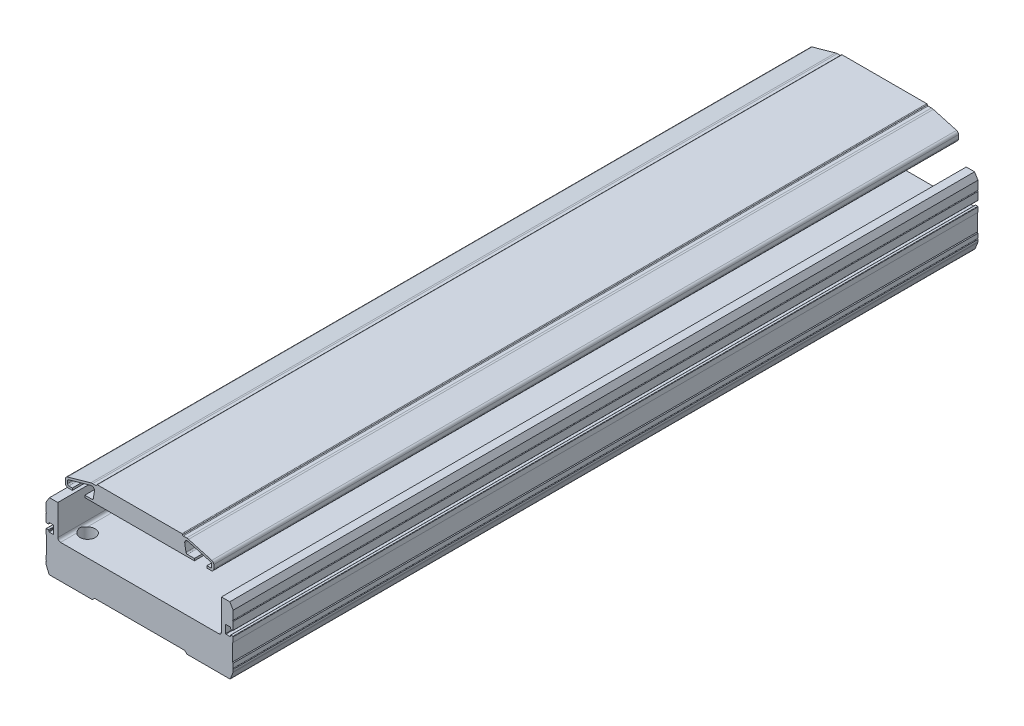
SolidWorks part; units mm, degrees
ref_plane "前视基准面" through (0, 0, 0) normal (0, 0, 1) x (1, 0, 0)
ref_plane "上视基准面" through (0, 0, 0) normal (0, 1, 0) x (1, 0, 0)
ref_plane "右视基准面" through (0, 0, 0) normal (1, 0, 0) x (0, 0, -1)
sketch "草图1" plane through (0, 0, 0) normal (0, 0, 1) x (1, 0, 0)
  line B0 (-39.5, 59.4) -> (39.5, 59.4)
  line B1 (39.5, 59.4) -> (39.5, 60.9)
  line B2 (39.5, 60.9) -> (34.4, 60.9)
  line B3 (33.4138, 61.7343) -> (32.5361, 66.9593)
  line B4 (35.0485, 69.2164) -> (51.27, 64.6675)
  line B5 (52, 63.7046) -> (52, 61.9)
  line B6 (51, 60.9) -> (48.5, 60.9)
  line B7 (48.5, 60.9) -> (48.5, 59.4)
  line B8 (48.5, 59.4) -> (51.5, 59.4)
  line B9 (53.5, 61.4) -> (53.5, 64.0837)
  line B10 (52.04, 66.0094) -> (35.2622, 70.7143)
  line B11 (33.9122, 70.9) -> (31.5, 70.9)
  line B12 (30.5, 71.9) -> (-30.5, 71.9)
  line B13 (-31.5, 70.9) -> (-33.9122, 70.9)
  line B14 (-35.2622, 70.7143) -> (-52.04, 66.0094)
  line B15 (-53.5, 64.0837) -> (-53.5, 61.4)
  line B16 (-51.5, 59.4) -> (-48.5, 59.4)
  line B17 (-48.5, 59.4) -> (-48.5, 60.9)
  line B18 (-48.5, 60.9) -> (-51, 60.9)
  line B19 (-52, 61.9) -> (-52, 63.7046)
  line B20 (-51.27, 64.6675) -> (-35.0485, 69.2164)
  line B21 (-32.5361, 66.9593) -> (-33.4138, 61.7343)
  line B22 (-34.4, 60.9) -> (-39.5, 60.9)
  line B23 (-39.5, 60.9) -> (-39.5, 59.4)
  line B24 (-67, 22) -> (-67, 10)
  line B25 (-67, 10) -> (-67.5, 9.5)
  line B26 (-67.5, 9.5) -> (-67.5, 6.375)
  line B27 (-67.5, 5.625) -> (-67.5, 4.3812)
  line B28 (-67.36, 3.6469) -> (-65.5064, -1.0289)
  line B29 (-65.16, -1.6) -> (-34.1, -1.6)
  line B30 (-34.1, -1.6) -> (-32.5, 0)
  line B31 (-32.5, 0) -> (32.5, 0)
  line B32 (32.5, 0) -> (34.1, -1.6)
  line B33 (34.1, -1.6) -> (65.16, -1.6)
  line B34 (65.5064, -1.0289) -> (67.36, 3.6469)
  line B35 (67.5, 4.3812) -> (67.5, 5.625)
  line B36 (67.5, 6.375) -> (67.5, 9.5)
  line B37 (67.5, 9.5) -> (67, 10)
  line B38 (67, 10) -> (67, 22)
  line B39 (67, 22) -> (67.5, 22.5)
  line B40 (67.5, 22.5) -> (67.5, 25.9)
  line B41 (67.2, 26.2) -> (65.8, 26.2)
  line B42 (65.5, 25.9) -> (65.5, 25.3)
  line B43 (65.2, 25) -> (62.3, 25)
  line B44 (62, 25.3) -> (62, 30.7)
  line B45 (62.3, 31) -> (65.2, 31)
  line B46 (65.5, 30.7) -> (65.5, 30.1)
  line B47 (65.8, 29.8) -> (67.2, 29.8)
  line B48 (67.5, 30.1) -> (67.5, 35.625)
  line B49 (67.5, 36.375) -> (67.5, 42.6)
  line B50 (67.5, 42.6) -> (65, 46.6)
  line B51 (65, 46.6) -> (59, 46.6)
  line B52 (59, 46.6) -> (59, 24.7)
  line B53 (57, 22.7) -> (-57, 22.7)
  line B54 (-59, 24.7) -> (-59, 46.6)
  line B55 (-59, 46.6) -> (-65, 46.6)
  line B56 (-65, 46.6) -> (-67.5, 42.6)
  line B57 (-67.5, 42.6) -> (-67.5, 36.375)
  line B58 (-67.5, 35.625) -> (-67.5, 30.1)
  line B59 (-67.2, 29.8) -> (-65.8, 29.8)
  line B60 (-65.5, 30.1) -> (-65.5, 30.7)
  line B61 (-65.2, 31) -> (-62.3, 31)
  line B62 (-62, 30.7) -> (-62, 25.3)
  line B63 (-62.3, 25) -> (-65.2, 25)
  line B64 (-65.5, 25.3) -> (-65.5, 25.9)
  line B65 (-65.8, 26.2) -> (-67.2, 26.2)
  line B66 (-67.5, 25.9) -> (-67.5, 22.5)
  line B67 (-67.5, 22.5) -> (-67, 22)
  arc B68 (33.4138, 61.7343) -> (34.4, 60.9) centre (34.4, 61.9) ccw
  arc B69 (35.0485, 69.2164) -> (32.5361, 66.9593) centre (34.5085, 67.2906) ccw
  arc B70 (52, 63.7046) -> (51.27, 64.6675) centre (51, 63.7046) ccw
  arc B71 (51, 60.9) -> (52, 61.9) centre (51, 61.9) ccw
  arc B72 (51.5, 59.4) -> (53.5, 61.4) centre (51.5, 61.4) ccw
  arc B73 (53.5, 64.0837) -> (52.04, 66.0094) centre (51.5, 64.0837) ccw
  arc B74 (35.2622, 70.7143) -> (33.9122, 70.9) centre (33.9122, 65.9) ccw
  arc B75 (31, 71.4) -> (31.5, 70.9) centre (31.5, 71.4) ccw
  arc B76 (31, 71.4) -> (30.5, 71.9) centre (30.5, 71.4) ccw
  arc B77 (-30.5, 71.9) -> (-31, 71.4) centre (-30.5, 71.4) ccw
  arc B78 (-31.5, 70.9) -> (-31, 71.4) centre (-31.5, 71.4) ccw
  arc B79 (-33.9122, 70.9) -> (-35.2622, 70.7143) centre (-33.9122, 65.9) ccw
  arc B80 (-52.04, 66.0094) -> (-53.5, 64.0837) centre (-51.5, 64.0837) ccw
  arc B81 (-53.5, 61.4) -> (-51.5, 59.4) centre (-51.5, 61.4) ccw
  arc B82 (-52, 61.9) -> (-51, 60.9) centre (-51, 61.9) ccw
  arc B83 (-51.27, 64.6675) -> (-52, 63.7046) centre (-51, 63.7046) ccw
  arc B84 (-32.5361, 66.9593) -> (-35.0485, 69.2164) centre (-34.5085, 67.2906) ccw
  arc B85 (-34.4, 60.9) -> (-33.4138, 61.7343) centre (-34.4, 61.9) ccw
  arc B86 (-67.5, 5.625) -> (-67.5, 6.375) centre (-67.5, 6) ccw
  arc B87 (-67.5, 4.3812) -> (-67.36, 3.6469) centre (-65.5, 4.382) ccw
  arc B88 (-65.5064, -1.0289) -> (-65.16, -1.6) centre (-63.6472, -0.2918) ccw
  arc B89 (65.16, -1.6) -> (65.5064, -1.0289) centre (63.6472, -0.2918) ccw
  arc B90 (67.36, 3.6469) -> (67.5, 4.3812) centre (65.5, 4.382) ccw
  arc B91 (67.5, 6.375) -> (67.5, 5.625) centre (67.5, 6) ccw
  arc B92 (67.5, 25.9) -> (67.2, 26.2) centre (67.2, 25.9) ccw
  arc B93 (65.8, 26.2) -> (65.5, 25.9) centre (65.8, 25.9) ccw
  arc B94 (65.2, 25) -> (65.5, 25.3) centre (65.2, 25.3) ccw
  arc B95 (62, 25.3) -> (62.3, 25) centre (62.3, 25.3) ccw
  arc B96 (62.3, 31) -> (62, 30.7) centre (62.3, 30.7) ccw
  arc B97 (65.5, 30.7) -> (65.2, 31) centre (65.2, 30.7) ccw
  arc B98 (65.5, 30.1) -> (65.8, 29.8) centre (65.8, 30.1) ccw
  arc B99 (67.2, 29.8) -> (67.5, 30.1) centre (67.2, 30.1) ccw
  arc B100 (67.5, 36.375) -> (67.5, 35.625) centre (67.5, 36) ccw
  arc B101 (57, 22.7) -> (59, 24.7) centre (57, 24.7) ccw
  arc B102 (-59, 24.7) -> (-57, 22.7) centre (-57, 24.7) ccw
  arc B103 (-67.5, 35.625) -> (-67.5, 36.375) centre (-67.5, 36) ccw
  arc B104 (-67.5, 30.1) -> (-67.2, 29.8) centre (-67.2, 30.1) ccw
  arc B105 (-65.8, 29.8) -> (-65.5, 30.1) centre (-65.8, 30.1) ccw
  arc B106 (-65.2, 31) -> (-65.5, 30.7) centre (-65.2, 30.7) ccw
  arc B107 (-62, 30.7) -> (-62.3, 31) centre (-62.3, 30.7) ccw
  arc B108 (-62.3, 25) -> (-62, 25.3) centre (-62.3, 25.3) ccw
  arc B109 (-65.5, 25.3) -> (-65.2, 25) centre (-65.2, 25.3) ccw
  arc B110 (-65.5, 25.9) -> (-65.8, 26.2) centre (-65.8, 25.9) ccw
  arc B111 (-67.2, 26.2) -> (-67.5, 25.9) centre (-67.2, 25.9) ccw
sketch_block_instance "块4-1"
sketch_block "块4"
extrude "凸台-拉伸1" add sketch "草图1" against normal blind 537
hole_wizard "打孔尺寸(%根据)内六角圆柱头螺钉的类型1" positions "草图3" profile "草图4" counterbore size "M6" standard "GB"
sketch "草图3" plane through (0, 46.6, 0) normal (0, 1, 0) x (1, 0, 0)
  line L4 (34.1, 537) -> (65.16, 537) construction
  line L5 (0, 537) -> (0, 1140.2602) construction
  line L6 (-32.5, 537) -> (32.5, 537) construction
  point P0 (-53, 465.5)
  point P2 (53, 465.5)
  point P13 (53, 415.5)
  point P15 (-53, 415.5)
  point P22 (53, 215.5)
  point P24 (-53, 215.5)
  point P25 (53, 15.5)
  point P27 (-53, 15.5)
  point P29 (53, -184.5)
  point P31 (-53, -184.5)
  point P33 (53, -384.5)
  point P35 (-53, -384.5)
  point P45 (-53, -584.5)
  point P47 (53, -584.5)
  dimension "D1" = 106
  dimension "D2" = 200
  dimension "D3" = 71.5
  dimension "D4" = 50
  dimension "D5" = 200
  dimension "D6" = 200
  dimension "D7" = 200
  dimension "D8" = 200
sketch "草图4" plane through (-53, 46.6, -465.5) normal (1, 0, 0) x (0, 0, 1)
  line L0 (0, 0) -> (0, 48.2)
  line L1 (0, 48.2) -> (3.5, 48.2)
  line L3 (3.5, 48.2) -> (3.5, 41)
  line L4 (3.5, 41) -> (5.5, 41)
  line L5 (5.5, 41) -> (5.5, 0)
  line L7 (5.5, 0) -> (0, 0)
  line L11 (0, -6.35) -> (0, 107.95) construction
  dimension "通孔孔直径" = 7
  dimension "通孔孔深度" = 48.2
  dimension "柱形沉头孔直径" = 11
  dimension "柱形沉头孔深度" = 41
hole_wizard "M6 螺纹孔0" positions "草图5" profile "草图6" tap size "M6" standard "GB"
sketch "草图5" plane through (0, -1.6, 0) normal (0, -1, 0) x (-1, 0, 0)
  line L0 (53, 465.5) -> (53, 475.5) construction
  line L1 (-53, 465.5) -> (-53, 475.5) construction
  line L4 (65.16, 537) -> (34.1, 537) construction
  point P0 (53, 475.5)
  point P2 (-53, 475.5)
  point P12 (53, 425.5)
  point P14 (-53, 425.5)
  point P19 (-53, 225.5)
  point P21 (53, 225.5)
  point P23 (-53, 25.5)
  point P25 (53, 25.5)
  point P27 (-53, -174.5)
  point P29 (53, -174.5)
  point P31 (-53, -374.5)
  point P33 (53, -374.5)
  point P36 (53, -574.5)
  point P38 (-53, -574.5)
  dimension "D1" = 61.5
  dimension "D2" = 50
  dimension "D3" = 200
  dimension "D4" = 200
  dimension "D5" = 200
  dimension "D6" = 200
  dimension "D7" = 200
sketch "草图6" plane through (-53, -1.6, -475.5) normal (1, 0, 0) x (0, 0, -1)
  line L0 (0, 0) -> (0, 16.5022)
  line L1 (0, 16.5022) -> (2.5, 15)
  line L2 (2.5, 15) -> (2.5, 0)
  line L5 (2.5, 0) -> (0, 0)
  line L10 (0, 16.5022) -> (-2.5, 15) construction
  line L11 (0, -6.35) -> (0, 107.95) construction
  dimension "螺纹孔钻头直径" = 5
  dimension "螺纹孔钻头深度" = 15
  dimension "导头角度" = 118
